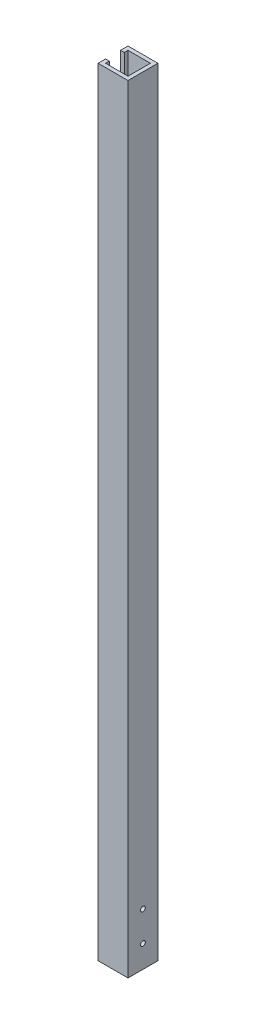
SolidWorks part; units mm, degrees
ref_plane "Front Plane" through (0, 0, 0) normal (0, 0, 1) x (1, 0, 0)
ref_plane "Top Plane" through (0, 0, 0) normal (0, 1, 0) x (1, 0, 0)
ref_plane "Right Plane" through (0, 0, 0) normal (1, 0, 0) x (0, 0, -1)
sketch "Sketch1" plane through (0, 0, 0) normal (0, 1, 0) x (1, 0, 0)
  line L0 (-9.525, 9.525) -> (9.525, 9.525)
  line L1 (-12.7, -12.7) -> (12.7, -12.7)
  line L2 (-12.7, -12.7) -> (-12.7, 12.7)
  line L3 (-12.7, 12.7) -> (12.7, 12.7)
  line L4 (12.7, -12.7) -> (12.7, 12.7)
  line L5 (-12.7, -12.7) -> (12.7, 12.7) construction
  line L6 (-12.7, 12.7) -> (12.7, -12.7) construction
  line L7 (9.525, -9.525) -> (9.525, 9.525)
  line L8 (-9.525, -9.525) -> (9.525, -9.525)
  line L9 (-9.525, -9.525) -> (-9.525, 9.525)
  point P0 (0, 0)
  dimension "D1" = 25.4
  dimension "D2" = 25.4
  dimension "D3" = 3.175
extrude "Boss-Extrude1" add sketch "Sketch1" along normal blind 660.4
sketch "Sketch2" plane through (12.7, 0, 0) normal (1, 0, 0) x (0, 0, -1)
  point P0 (0, 19.05)
  point P1 (0, 44.45)
  dimension "D1" = 19.05
  dimension "D2" = 25.4
hole_wizard "#10-32 Tapped Hole1" positions "Sketch4" profile "Sketch3" tap size "#10-32" standard "ANSI Inch"
sketch "Sketch4" plane through (12.7, 0, 0) normal (1, 0, 0) x (0, 0, -1)
  point P0 (0, 44.45)
  point P3 (0, 19.05)
sketch "Sketch3" plane through (12.7, 44.45, 0) normal (0, 1, 0) x (0, 0, -1)
  line L0 (0, 0) -> (0, 25.4)
  line L1 (0, 25.4) -> (2.0193, 25.4)
  line L2 (2.0193, 25.4) -> (2.0193, 0)
  line L5 (2.0193, 0) -> (0, 0)
  line L11 (0, -6.35) -> (0, 107.95) construction
  dimension "Thru Tap Drill Dia." = 4.0386
  dimension "Thru Tap Drill Depth" = 25.4
sketch "Sketch6" plane through (-12.7, 0, 0) normal (-1, 0, 0) x (0, 0, 1)
  line L0 (-12.7, 660.4) -> (12.7, 660.4) construction
  line L1 (6.35, 660.4) -> (-6.35, 660.4)
  line L2 (6.35, 660.4) -> (6.35, 596.9)
  line L3 (6.35, 596.9) -> (-6.35, 596.9)
  line L4 (-6.35, 660.4) -> (-6.35, 596.9)
  line L5 (-12.7, 660.4) -> (-12.7, 0) construction
  dimension "D1" = 6.35
  dimension "D2" = 6.35
  dimension "D3" = 63.5
extrude "Cut-Extrude1" cut sketch "Sketch6" against normal blind 3.175
sketch "Sketch7" plane through (0, 0, -12.7) normal (0, 0, -1) x (-1, 0, 0)
  line L0 (0, 0) -> (0, 25.4) construction
  line L1 (-8.89, 0) -> (-8.89, 25.4)
  line L2 (8.89, 0) -> (8.89, 25.4)
  arc A0 (-8.89, 0) -> (8.89, 0) centre (0, 0) ccw
  arc A1 (8.89, 25.4) -> (-8.89, 25.4) centre (0, 25.4) ccw
  point P3 (0, 12.7)
  dimension "D1" = 8.89
  dimension "D2" = 25.4
extrude "Cut-Extrude9" cut sketch "Sketch7" against normal up to next
